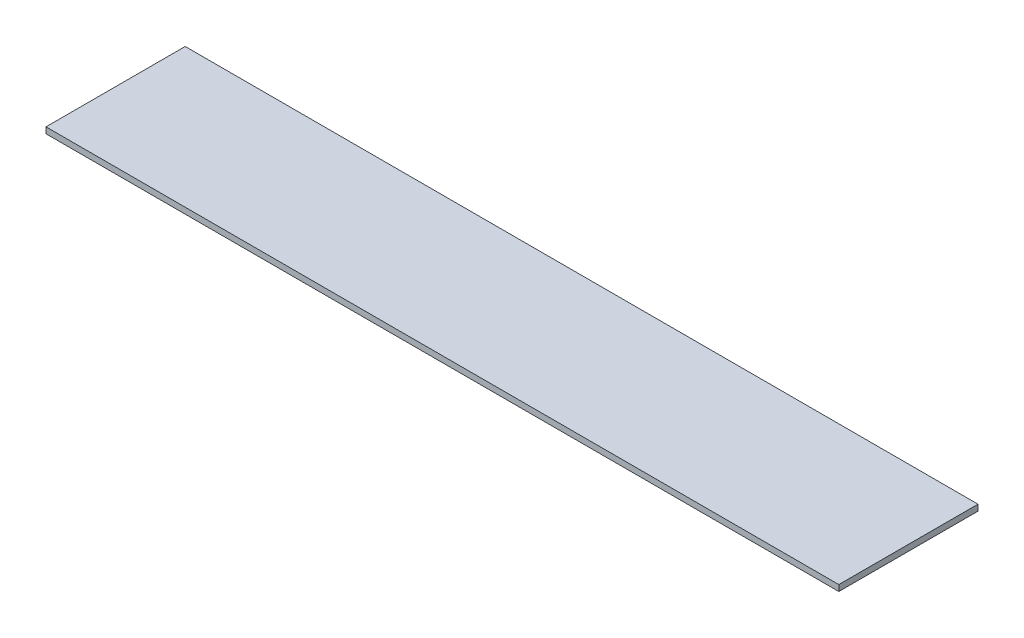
SolidWorks part; units mm, degrees
ref_plane "Front Plane" through (0, 0, 0) normal (0, 0, 1) x (1, 0, 0)
ref_plane "Top Plane" through (0, 0, 0) normal (0, 1, 0) x (1, 0, 0)
ref_plane "Right Plane" through (0, 0, 0) normal (1, 0, 0) x (0, 0, -1)
sketch "Sketch1" plane through (0, 0, 0) normal (0, 1, 0) x (1, 0, 0)
  line L1 (-831.85, -146.05) -> (831.85, -146.05)
  line L2 (-831.85, -146.05) -> (-831.85, 146.05)
  line L3 (-831.85, 146.05) -> (831.85, 146.05)
  line L4 (831.85, -146.05) -> (831.85, 146.05)
  line L5 (-831.85, -146.05) -> (831.85, 146.05) construction
  line L6 (-831.85, 146.05) -> (831.85, -146.05) construction
  point P0 (0, 0)
  dimension "D1" = 1663.7
  dimension "D2" = 292.1
extrude "Boss-Extrude1" add sketch "Sketch1" along normal blind 12.7
